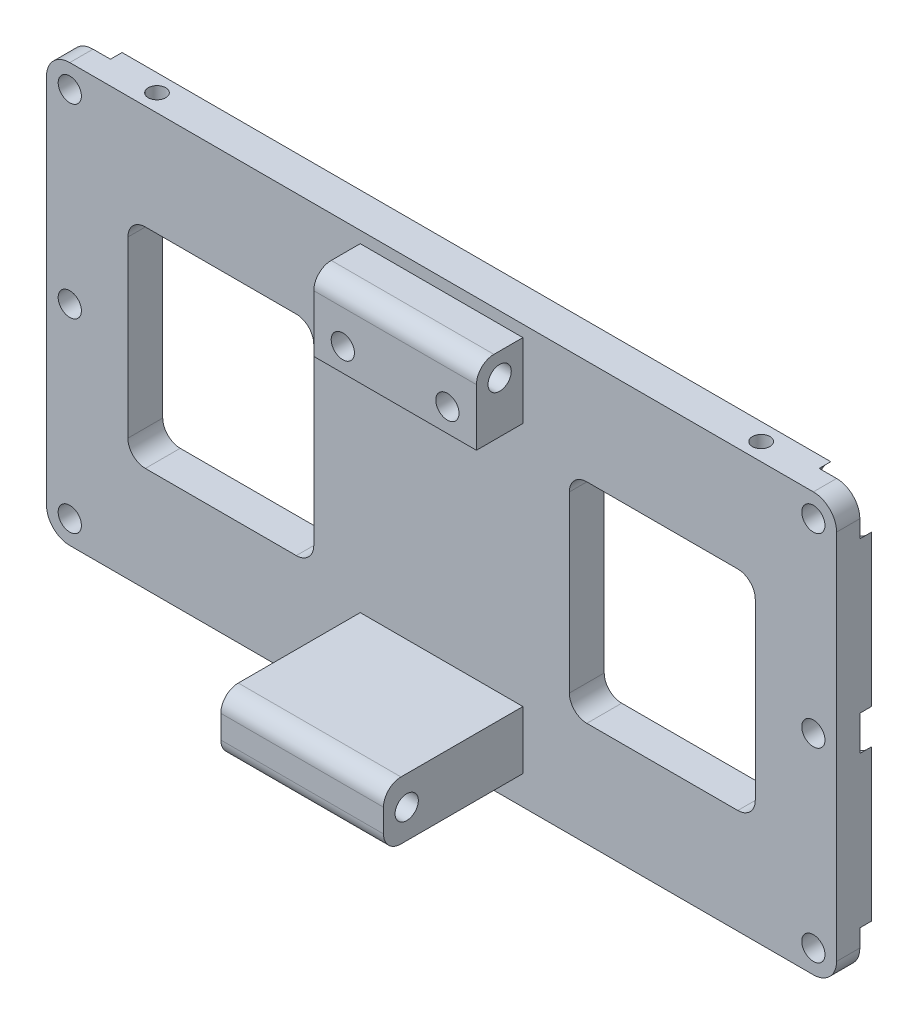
SolidWorks part; units mm, degrees
ref_plane "Front Plane" through (0, 0, 0) normal (0, 0, 1) x (1, 0, 0)
ref_plane "Top Plane" through (0, 0, 0) normal (0, 1, 0) x (1, 0, 0)
ref_plane "Right Plane" through (0, 0, 0) normal (1, 0, 0) x (0, 0, -1)
sketch "Sketch1" plane through (0, 0, 0) normal (0, 0, 1) x (1, 0, 0)
  line L0 (0, 0) -> (41.4206, 0) construction
  line L1 (0, 0) -> (0, 25.506) construction
  line L2 (-107.95, -57.15) -> (107.95, -57.15)
  line L3 (107.95, -57.15) -> (107.95, 57.15)
  line L4 (107.95, 57.15) -> (-107.95, 57.15)
  line L5 (-107.95, 57.15) -> (-107.95, -57.15)
  line L6 (22.225, 47.625) -> (-22.225, 47.625) construction
  line L7 (-22.225, 53.975) -> (22.225, 53.975)
  line L8 (-22.225, 53.975) -> (-22.225, 33.655)
  line L9 (-22.225, 33.655) -> (22.225, 33.655)
  line L10 (22.225, 53.975) -> (22.225, 33.655)
  line L11 (-107.95, 0) -> (-101.6, 0) construction
  line L12 (-85.725, 28.575) -> (-34.925, 28.575)
  line L13 (-22.225, -33.3375) -> (22.225, -33.3375)
  line L14 (-22.225, -33.3375) -> (-22.225, -49.2125)
  line L15 (-22.225, -49.2125) -> (22.225, -49.2125)
  line L16 (22.225, -33.3375) -> (22.225, -49.2125)
  line L17 (-85.725, 28.575) -> (-85.725, -28.575)
  line L18 (-85.725, -28.575) -> (-34.925, -28.575)
  line L19 (-22.225, -41.275) -> (-19.4926, -41.275) construction
  line L20 (-34.925, 28.575) -> (-34.925, -28.575)
  line L21 (-85.725, 28.575) -> (-34.925, -28.575) construction
  line L22 (-85.725, -28.575) -> (-34.925, 28.575) construction
  line L23 (34.925, 28.575) -> (85.725, 28.575)
  line L24 (34.925, 28.575) -> (34.925, -28.575)
  line L25 (34.925, -28.575) -> (85.725, -28.575)
  line L26 (85.725, 28.575) -> (85.725, -28.575)
  line L27 (34.925, 28.575) -> (85.725, -28.575) construction
  line L28 (34.925, -28.575) -> (85.725, 28.575) construction
  circle A0 centre (-101.6, 50.8) radius 3.175
  circle A1 centre (101.6, 50.8) radius 3.175
  circle A2 centre (-101.6, -50.8) radius 3.175
  circle A3 centre (101.6, -50.8) radius 3.175
  circle A4 centre (14.2875, 40.005) radius 3.175
  circle A5 centre (-14.2875, 40.005) radius 3.175
  circle A6 centre (-14.2875, -41.275) radius 3.9624
  circle A7 centre (14.2875, -41.275) radius 3.9624
  circle A8 centre (-101.6, 50.8) radius 7.9375
  circle A9 centre (-101.6, -50.8) radius 7.9375
  circle A10 centre (101.6, 50.8) radius 7.9375
  circle A11 centre (101.6, -50.8) radius 7.9375
  circle A12 centre (-101.6, 0) radius 3.175
  circle A13 centre (-101.6, 0) radius 7.9375
  circle A14 centre (101.6, 0) radius 3.175
  circle A15 centre (101.6, 0) radius 7.9375
  point P40 (-60.325, 0)
  point P45 (60.325, 0)
  dimension "D1" = 6.35
  dimension "D11" = 6.35
  dimension "D15" = 7.9248
  dimension "D17" = 15.875
  dimension "D2" = 101.6
  dimension "D3" = 203.2
  dimension "D4" = 114.3
  dimension "D5" = 215.9
  dimension "D6" = 20.32
  dimension "D7" = 87.3125
  dimension "D8" = 3.175
  dimension "D9" = 44.45
  dimension "D10" = 15.875
  dimension "D12" = 6.35
  dimension "D13" = 28.575
  dimension "D14" = 6.35
  dimension "D16" = 28.575
  dimension "D18" = 22.225
  dimension "D19" = 57.15
  dimension "D20" = 50.8
  dimension "D21" = 98.425
  dimension "D22" = 17.145
sketch "Sketch2" plane through (0, 0, 0) normal (0, 0, 1) x (1, 0, 0)
  line L0 (-107.95, 57.15) -> (-107.95, -57.15) construction
  line L1 (-107.95, -57.15) -> (107.95, -57.15) construction
  line L2 (107.95, -57.15) -> (107.95, 57.15) construction
  line L3 (107.95, 57.15) -> (-107.95, 57.15) construction
  line L4 (-107.95, 57.15) -> (-107.95, -57.15)
  line L5 (-107.95, -57.15) -> (107.95, -57.15)
  line L6 (107.95, -57.15) -> (107.95, 57.15)
  line L7 (107.95, 57.15) -> (-107.95, 57.15)
  line L8 (-85.725, -28.575) -> (-34.925, -28.575) construction
  line L9 (-34.925, 28.575) -> (-34.925, -28.575) construction
  line L10 (-85.725, 28.575) -> (-34.925, 28.575) construction
  line L11 (-85.725, 28.575) -> (-85.725, -28.575) construction
  line L12 (34.925, -28.575) -> (85.725, -28.575) construction
  line L13 (85.725, 28.575) -> (85.725, -28.575) construction
  line L14 (34.925, 28.575) -> (85.725, 28.575) construction
  line L15 (34.925, 28.575) -> (34.925, -28.575) construction
  line L16 (-85.725, -28.575) -> (-34.925, -28.575)
  line L17 (-34.925, 28.575) -> (-34.925, -28.575)
  line L18 (-85.725, 28.575) -> (-34.925, 28.575)
  line L19 (-85.725, 28.575) -> (-85.725, -28.575)
  line L20 (34.925, -28.575) -> (85.725, -28.575)
  line L21 (85.725, 28.575) -> (85.725, -28.575)
  line L22 (34.925, 28.575) -> (85.725, 28.575)
  line L23 (34.925, 28.575) -> (34.925, -28.575)
  circle A0 centre (-101.6, 50.8) radius 3.175 construction
  circle A1 centre (-101.6, -50.8) radius 3.175 construction
  circle A2 centre (101.6, -50.8) radius 3.175 construction
  circle A3 centre (101.6, 50.8) radius 3.175 construction
  circle A4 centre (-101.6, 50.8) radius 3.175
  circle A5 centre (-101.6, -50.8) radius 3.175
  circle A6 centre (101.6, -50.8) radius 3.175
  circle A7 centre (101.6, 50.8) radius 3.175
  circle A8 centre (101.6, 0) radius 3.175 construction
  circle A9 centre (-101.6, 0) radius 3.175 construction
  circle A10 centre (101.6, 0) radius 3.175
  circle A11 centre (-101.6, 0) radius 3.175
extrude "Boss-Extrude1" add sketch "Sketch2" against normal blind 9.525
sketch "Sketch4" plane through (0, 0, 0) normal (0, 0, 1) x (1, 0, 0)
  line L0 (-22.225, 33.655) -> (22.225, 33.655) construction
  line L1 (22.225, 53.975) -> (22.225, 33.655) construction
  line L2 (-22.225, 53.975) -> (22.225, 53.975) construction
  line L3 (-22.225, 53.975) -> (-22.225, 33.655) construction
  line L4 (-22.225, 33.655) -> (22.225, 33.655)
  line L5 (22.225, 53.975) -> (22.225, 33.655)
  line L6 (-22.225, 53.975) -> (22.225, 53.975)
  line L7 (-22.225, 53.975) -> (-22.225, 33.655)
extrude "Boss-Extrude2" add sketch "Sketch4" along normal blind 12.7 separate body
sketch "Sketch6" plane through (-22.225, 0, 0) normal (-1, 0, 0) x (0, 0, 1)
  line L0 (0, 47.625) -> (6.35, 47.625) construction
  circle A0 centre (6.35, 47.625) radius 3.175
  dimension "D1" = 6.35
  dimension "D2" = 6.35
extrude "Cut-Extrude2" cut sketch "Sketch6" against normal blind 45.72
sketch "Sketch7" plane through (0, 0, 0) normal (0, 0, 1) x (1, 0, 0)
  circle A0 centre (-14.2875, 40.005) radius 3.175 construction
  circle A1 centre (14.2875, 40.005) radius 3.175 construction
  circle A2 centre (-14.2875, 40.005) radius 3.175
  circle A3 centre (14.2875, 40.005) radius 3.175
extrude "Cut-Extrude3" cut sketch "Sketch7" against normal mid plane 45.72
sketch "Sketch8" plane through (0, 0, 0) normal (0, 0, 1) x (1, 0, 0)
  line L0 (-22.225, -49.2125) -> (22.225, -49.2125) construction
  line L1 (22.225, -33.3375) -> (22.225, -49.2125) construction
  line L2 (-22.225, -33.3375) -> (22.225, -33.3375) construction
  line L3 (-22.225, -33.3375) -> (-22.225, -49.2125) construction
  line L4 (-22.225, -49.2125) -> (22.225, -49.2125)
  line L5 (22.225, -33.3375) -> (22.225, -49.2125)
  line L6 (-22.225, -33.3375) -> (22.225, -33.3375)
  line L7 (-22.225, -33.3375) -> (-22.225, -49.2125)
extrude "Boss-Extrude3" add sketch "Sketch8" along normal blind 38.1 separate body
sketch "Sketch9" plane through (-22.225, 0, 0) normal (-1, 0, 0) x (0, 0, 1)
  line L0 (0, -41.275) -> (31.75, -41.275) construction
  line L1 (0, -33.3375) -> (0, -49.2125) construction
  circle A0 centre (31.75, -41.275) radius 3.175
  dimension "D2" = 6.35
  dimension "D1" = 31.75
extrude "Cut-Extrude4" cut sketch "Sketch9" against normal blind 46.355
sketch "Sketch10" plane through (0, 0, 0) normal (0, 0, 1) x (1, 0, 0)
  circle A0 centre (-14.2875, -41.275) radius 3.9624 construction
  circle A1 centre (14.2875, -41.275) radius 3.9624 construction
  circle A2 centre (-14.2875, -41.275) radius 3.9624
  circle A3 centre (14.2875, -41.275) radius 3.9624
extrude "Cut-Extrude5" cut sketch "Sketch10" against normal blind 12.7 and the other way blind 15.875
fillet "Fillet1" radius 6.35 4 edges at (107.95, 57.15, -4.7625) (107.95, -57.15, -4.7625) (-107.95, -57.15, -4.7625) (-107.95, 57.15, -4.7625)
fillet "Fillet2" radius 4.7752 2 edges at (0, -49.2125, 38.1) (0, -33.3375, 38.1)
fillet "Fillet3" radius 4.7752 1 edges at (0, 53.975, 12.7)
sketch "Sketch11" plane through (0, 0, 0) normal (0, 0, 1) x (1, 0, 0)
  circle A0 centre (-101.6, 50.8) radius 7.9375 construction
  circle A1 centre (-101.6, -50.8) radius 7.9375 construction
  circle A2 centre (101.6, -50.8) radius 7.9375 construction
  circle A3 centre (101.6, 50.8) radius 7.9375 construction
  circle A4 centre (-101.6, 50.8) radius 7.9375
  circle A5 centre (-101.6, -50.8) radius 7.9375
  circle A6 centre (101.6, -50.8) radius 7.9375
  circle A7 centre (101.6, 50.8) radius 7.9375
  circle A8 centre (101.6, 0) radius 7.9375 construction
  circle A9 centre (-101.6, 0) radius 7.9375 construction
  circle A10 centre (101.6, 0) radius 7.9375
  circle A11 centre (-101.6, 0) radius 7.9375
extrude "Cut-Extrude6" cut sketch "Sketch11" against normal blind 10.16 from offset 6.35
fillet "Fillet4" radius 4.7752 8 edges at (34.925, -28.575, -4.7625) (85.725, -28.575, -4.7625) (85.725, 28.575, -4.7625) (34.925, 28.575, -4.7625) (-85.725, -28.575, -4.7625) (-34.925, -28.575, -4.7625) (-34.925, 28.575, -4.7625) (-85.725, 28.575, -4.7625)
sketch "Sketch12" plane through (0, 57.15, 0) normal (0, 1, 0) x (1, 0, 0)
  line L0 (0, 0) -> (0, 24.7827) construction
  line L1 (101.6, 0) -> (-101.6, 0) construction
  circle A0 centre (-82.55, 4.7752) radius 2.3876
  circle A1 centre (82.55, 4.7752) radius 2.3876
  dimension "D1" = 4.7752
  dimension "D2" = 4.7752
  dimension "D3" = 165.1
extrude "Cut-Extrude7" cut sketch "Sketch12" against normal blind 14.224
